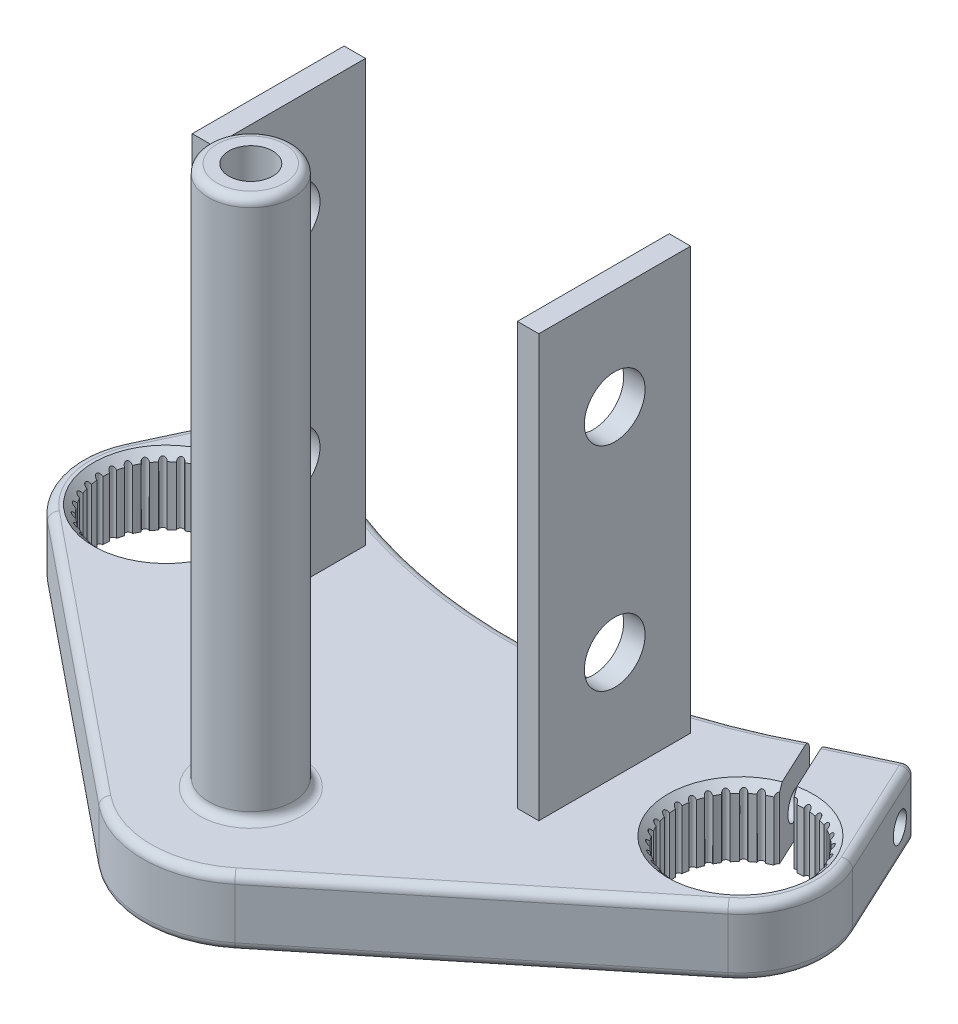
SolidWorks part; units mm, degrees
ref_plane "Front Plane" through (0, 0, 0) normal (0, 0, 1) x (1, 0, 0)
ref_plane "Top Plane" through (0, 0, 0) normal (0, 1, 0) x (1, 0, 0)
ref_plane "Right Plane" through (0, 0, 0) normal (1, 0, 0) x (0, 0, -1)
sketch "Sketch2" plane through (0, 0, 0) normal (0, 1, 0) x (1, 0, 0)
  line L0 (0, 0) -> (0, 148.5251) construction
  line L1 (100.8468, -19.4175) -> (20.1559, -84.8544)
  line L2 (-100.8468, -19.4175) -> (-20.1559, -84.8544)
  line L3 (-107.7577, 10.5655) -> (-91.6982, 45.0052)
  line L4 (107.7577, 10.5655) -> (91.6982, 45.0052)
  line L5 (-78.7127, 17.2468) -> (-51.9693, 74.5983) construction
  line L6 (-81.8848, 18.726) -> (-55.1414, 76.0775) construction
  line L7 (-81.8848, 18.726) -> (-73.572, 36.5528)
  line L8 (81.8848, 18.726) -> (73.572, 36.5528)
  line L9 (94.8661, -9.1125) -> (53.0102, 80.6477) construction
  line L10 (91.6941, -10.5917) -> (49.8382, 79.1685) construction
  line L11 (-91.6982, 45.0052) -> (-73.572, 36.5528)
  line L12 (91.6982, 45.0052) -> (73.572, 36.5528)
  line L13 (-78.4548, 17.8) -> (-70.3357, 35.2115)
  line L14 (78.4548, 17.8) -> (70.3357, 35.2115)
  arc A0 (78.4548, 17.8) -> (81.8848, 18.726) centre (85.1, 0) ccw
  arc A1 (100.8468, -19.4175) -> (107.7577, 10.5655) centre (85.1, 0) ccw
  arc A2 (-100.8468, -19.4175) -> (-107.7577, 10.5655) centre (-85.1, 0) cw
  arc A3 (-20.1559, -84.8544) -> (20.1559, -84.8544) centre (0, -60) ccw
  arc A5 (-81.8848, 18.726) -> (-78.4548, 17.8) centre (-85.1, 0) ccw
  arc A6 (81.8848, 18.726) -> (78.4548, 17.8) centre (85.1, 0) cw
  arc A9 (-70.3357, 35.2115) -> (70.3357, 35.2115) centre (0, 169.959) ccw
  point P1 (-74.3952, 26.5058)
  dimension "D2" = 19
  dimension "D4" = 32
  dimension "D7" = 152
  dimension "D11" = 20
  dimension "D14" = 25
  dimension "D10" = 25
  dimension "D3" = 3.5
  dimension "D5" = 60
  dimension "D6" = 38
  dimension "D8" = 3.5
  dimension "D9" = 20
  dimension "D13" = 170.2
extrude "Boss-Extrude1" add sketch "Sketch2" along normal blind 20 contours A9 L13 A5 L7 L11 L3 A2 L2 A3 L1 A1 L4 L12 L8 A0 L14
sketch "Sketch3" plane through (0, 20, 0) normal (0, 1, 0) x (1, 0, 0)
  circle A0 centre (0, -60) radius 12.5
  dimension "D1" = 25
extrude "Boss-Extrude2" add sketch "Sketch3" along normal blind 160
sketch "Sketch4" plane through (0, 20, 0) normal (0, 1, 0) x (1, 0, 0)
  line L0 (0, 0) -> (0, 47.3846) construction
  line L1 (-45, -26) -> (-45, 19)
  line L2 (-45, 19) -> (-51.35, 19)
  line L3 (-51.35, 19) -> (-51.35, -26)
  line L4 (-51.35, -26) -> (-45, -26)
  line L5 (51.35, -26) -> (45, -26)
  line L6 (51.35, 19) -> (51.35, -26)
  line L7 (45, 19) -> (51.35, 19)
  line L8 (45, -26) -> (45, 19)
  arc A0 (-81.8848, 18.726) -> (-78.4548, 17.8) centre (-85.1, 0) ccw construction
  dimension "D1" = 6.35
  dimension "D2" = 45
  dimension "D3" = 26
  dimension "D4" = 90
extrude "Boss-Extrude3" add sketch "Sketch4" along normal blind 125
other "Hole1" parameters "D1"=25
sketch "Sketch6" plane through (0, 180, 0) normal (0, 1, 0) x (1, 0, 0)
  circle A0 centre (0, -60) radius 6.5
  circle A1 centre (0, -60) radius 12.5 construction
  dimension "D1" = 13
sketch "Sketch7" plane through (92.5583, 0, -43.1606) normal (0.9063, 0, -0.4226) x (-0.4226, 0, -0.9063)
  line L0 (-35.9648, 0) -> (2.0352, 0) construction
  line L1 (2.0352, 20) -> (2.0352, 0) construction
  circle A0 centre (-6.9648, 9) radius 4
  dimension "D1" = 8
  dimension "D2" = 9
  dimension "D3" = 9
extrude "Cut-Extrude1" cut sketch "Sketch7" against normal blind 32
mirror "Mirror1" about plane through (0, 0, 0) normal (1, 0, 0) of "Cut-Extrude1"
chamfer "Chamfer1" distance 2.5 angle 45 2 edges at (90.0519, 20, 18.3434) (-90.0519, 20, 18.3434)
sketch "Sketch8" plane through (0, 20, 0) normal (0, 1, 0) x (1, 0, 0)
  circle A0 centre (78.4548, 17.8) radius 0.9
  dimension "D1" = 1.8
extrude "Cut-Extrude2" cut sketch "Sketch8" against normal through all
pattern_circular "CirPattern1" count 32 over 360 about axis through (85.1, 0, 0) along (0, 1, 0) of "Cut-Extrude2"
mirror "Mirror2" about plane through (0, 0, 0) normal (1, 0, 0) of "CirPattern1", "Cut-Extrude2"
fillet "Fillet1" radius 2.5 24 edges at (-99.7279, 0, -27.7853) (-109.4612, 0, 5.6151) (-60.5013, 0, 52.1359) (0, 0, 92) (60.5013, 0, 52.1359) (109.4612, 0, 5.6151) (-99.7279, 20, -27.7853) (-109.4612, 20, 5.6151) (-60.5013, 20, 52.1359) (0, 20, 92) (60.5013, 20, 52.1359) (109.4612, 20, 5.6151) (99.7279, 0, -27.7853) (99.7279, 20, -27.7853) (0, 180, 72.5) (0, 20, 72.5) (-91.6982, 10, -45.0052) (91.6982, 10, -45.0052) (82.6351, 0, -40.779) (-82.6351, 0, -40.779) (0, 0, -17.959) (-82.6351, 20, -40.779) (82.6351, 20, -40.779) (0, 20, -17.959)
sketch "Sketch9" plane through (0, 0, 0) normal (1, 0, 0) x (0, 0, -1)
  line L0 (-3.5, 115) -> (-3.5, 52) construction
  line L1 (19, 145) -> (19, 20) construction
  line L2 (-26, 145) -> (19, 145) construction
  circle A0 centre (-3.5, 115) radius 9
  circle A1 centre (-3.5, 52) radius 9
  dimension "D1" = 18
  dimension "D2" = 18
  dimension "D4" = 22.5
  dimension "D3" = 63
  dimension "D5" = 30
extrude "Cut-Extrude3" cut sketch "Sketch9" against normal through all both and the other way through all
